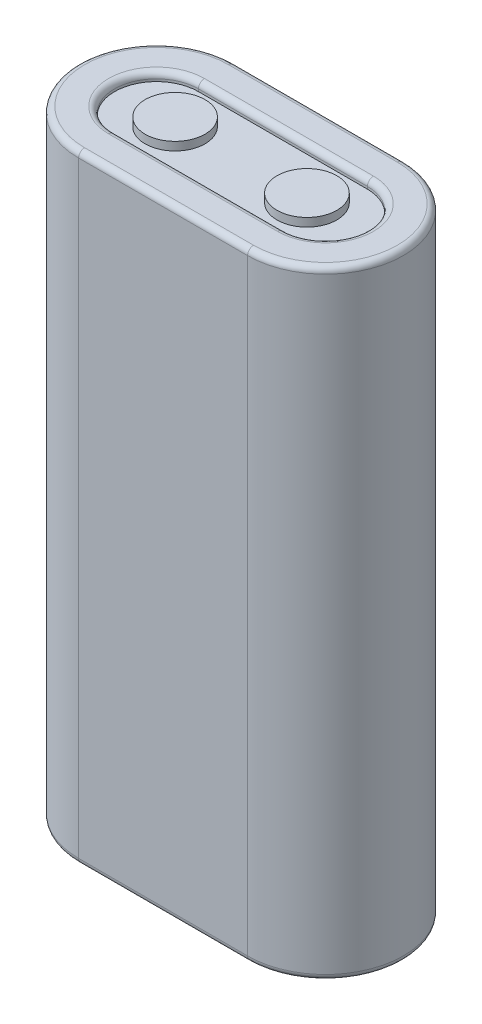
SolidWorks part; units mm, degrees
ref_plane "Front" through (0, 0, 0) normal (0, 0, 1) x (1, 0, 0)
ref_plane "Top" through (0, 0, 0) normal (0, 1, 0) x (1, 0, 0)
ref_plane "Right" through (0, 0, 0) normal (1, 0, 0) x (0, 0, -1)
sketch "Sketch1" plane through (0, 0, 0) normal (0, 1, 0) x (1, 0, 0)
  line L0 (0, -50) -> (0, 50) construction
  line L1 (7.05, 34.5994) -> (7.05, -22.5111) construction
  line L2 (-50, 0) -> (50, 0) construction
  line L4 (7.05, -6.5) -> (0, -6.5)
  line L5 (0, -6.5) -> (0, 6.5)
  line L6 (7.05, 0) -> (35.2719, 0) construction
  line L7 (7.05, 6.5) -> (0, 6.5)
  arc A0 (7.05, -6.5) -> (7.05, 6.5) centre (7.05, 0) ccw
  dimension "D2" = 13
  dimension "D1" = 7.05
  dimension "D4" = 13.55
extrude "Base-Extrude" add sketch "Sketch1" along normal blind 51.6
sketch "Sketch2" plane through (0, 51.6, 0) normal (0, 1, 0) x (-1, 0, 0)
  line L3 (-7.05, 0) -> (7.5517, 0) construction
  line L4 (0, -3.5) -> (0, -6.5)
  line L5 (0, -6.5) -> (-7.05, -6.5)
  line L6 (-7.05, -3.5) -> (-3, -3.5)
  line L7 (0, -3.5) -> (-7.05, -3.5)
  line L8 (-7.05, -6.5) -> (0, -6.5)
  line L9 (-3, 3.5) -> (-7.05, 3.5)
  line L10 (-3, -3.5) -> (-3, 3.5)
  line L12 (0, 3.5) -> (-7.05, 3.5)
  line L13 (0, 6.5) -> (-7.05, 6.5)
  line L14 (0, -6.5) -> (0, 6.5)
  line L16 (0, 6.5) -> (-7.05, 6.5)
  line L17 (0, 3.5) -> (0, 6.5)
  circle A1 centre (-5.5, 0) radius 2.5
  arc A4 (-7.05, 3.5) -> (-7.05, -3.5) centre (-7.05, 0) ccw
  arc A5 (-7.05, 3.5) -> (-7.05, -3.5) centre (-7.05, 0) ccw
  arc A6 (-7.05, 6.5) -> (-7.05, -6.5) centre (-7.05, 0) ccw
  arc A7 (-7.05, 6.5) -> (-7.05, -6.5) centre (-7.05, 0) ccw
  dimension "D1" = 5
  dimension "D2" = 5.5
  dimension "D3" = 3
  dimension "D4" = 0
extrude "Cut-Extrude1" cut sketch "Sketch2" against normal blind 0.7 flip side to cut
mirror "Mirror All1" about plane through (0, 51.6, 6.5) normal (1, 0, 0)
fillet "Fillet1" radius 0.5 12 edges at (13.55, 51.6, 0) (0, 51.6, -6.5) (0, 51.6, 3.5) (10.55, 51.6, 0) (0, 51.6, -3.5) (0, 0, -6.5) (13.55, 0, 0) (0, 0, 6.5) (-13.55, 51.6, 0) (-13.55, 0, 0) (-10.55, 51.6, 0) (0, 51.6, 6.5)
